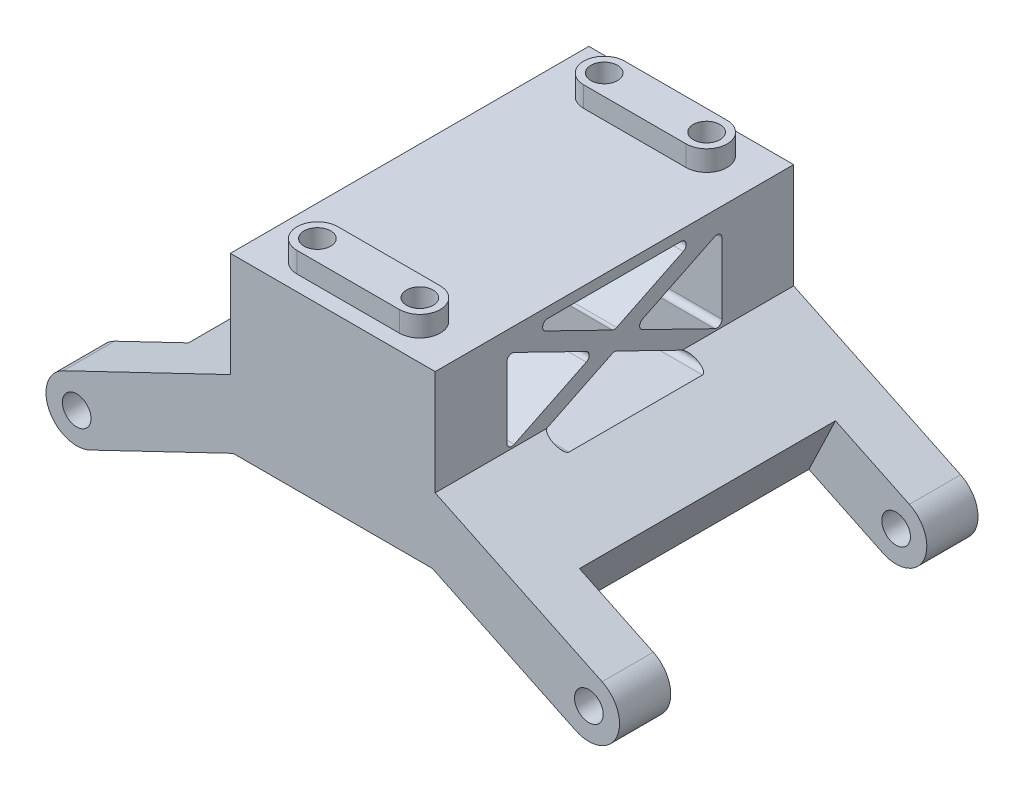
SolidWorks part; units mm, degrees
ref_plane "Front Plane" through (0, 0, 0) normal (0, 0, 1) x (1, 0, 0)
ref_plane "Top Plane" through (0, 0, 0) normal (0, 1, 0) x (1, 0, 0)
ref_plane "Right Plane" through (0, 0, 0) normal (1, 0, 0) x (0, 0, -1)
sketch "Sketch1" plane through (0, 0, 0) normal (0, 0, 1) x (1, 0, 0)
  line L0 (-31.75, -10.16) -> (31.75, -10.16) construction
  line L1 (-31.75, 15.24) -> (31.75, 15.24) construction
  line L2 (-31.75, 15.24) -> (-31.75, -15.24) construction
  line L3 (-31.75, -15.24) -> (31.75, -15.24) construction
  line L4 (31.75, 15.24) -> (31.75, -15.24) construction
  line L5 (-31.75, 15.24) -> (31.75, -15.24) construction
  line L6 (-31.75, -15.24) -> (31.75, 15.24) construction
  line L7 (-30.1013, -18.6748) -> (-12.3621, -10.16)
  line L8 (0, 15.24) -> (0, -15.24) construction
  line L9 (-30.1013, -18.6748) -> (-33.3987, -11.8052) construction
  line L10 (-33.3987, -11.8052) -> (-12.7, -1.8698)
  line L11 (12.3621, -10.16) -> (-12.3621, -10.16)
  line L12 (-12.7, 11.1536) -> (12.7, 11.1536)
  line L13 (-31.75, 11.1536) -> (0, 11.1536) construction
  line L14 (-12.7, -1.8698) -> (-12.7, 11.1536)
  line L15 (30.1013, -18.6748) -> (12.3621, -10.16)
  line L16 (33.3987, -11.8052) -> (12.7, -1.8698)
  line L17 (12.7, -1.8698) -> (12.7, 11.1536)
  arc A0 (-33.3987, -11.8052) -> (-30.1013, -18.6748) centre (-31.75, -15.24) ccw
  circle A3 centre (-31.75, 15.24) radius 4.0864 construction
  arc A4 (33.3987, -11.8052) -> (30.1013, -18.6748) centre (31.75, -15.24) cw
  point P0 (0, 0)
  point P9 (0, -10.16)
  dimension "D4" = 7.62
  dimension "D1" = 63.5
  dimension "D2" = 30.48
  dimension "D3" = 25.4
  dimension "D5" = 12.7
extrude "Boss-Extrude1" add sketch "Sketch1" along normal mid plane 44.45
sketch "Sketch3" plane through (-1.6487, 3.4348, 0) normal (-0.4327, 0.9015, 0) x (0.9015, 0.4327, 0)
  line L0 (-35.2182, -22.225) -> (-35.2182, 22.225) construction
  line L1 (-45.3782, 15.875) -> (-25.0582, 15.875)
  line L2 (-45.3782, 15.875) -> (-45.3782, -15.875)
  line L3 (-45.3782, -15.875) -> (-25.0582, -15.875)
  line L4 (-25.0582, 15.875) -> (-25.0582, -15.875)
  line L5 (-45.3782, 15.875) -> (-25.0582, -15.875) construction
  line L6 (-45.3782, -15.875) -> (-25.0582, 15.875) construction
  point P0 (-35.2182, 0)
  dimension "D1" = 10.16
  dimension "D2" = 31.75
extrude "Cut-Extrude1" cut sketch "Sketch3" against normal through all
mirror "Mirror1" about plane through (0, 0, 0) normal (1, 0, 0) of "Cut-Extrude1"
sketch "Sketch4" plane through (0, 11.1536, 0) normal (0, 1, 0) x (1, 0, 0)
  line L0 (0, 17.78) -> (0, -17.78) construction
  line L1 (-6.35, 17.78) -> (6.35, 17.78) construction
  line L2 (-6.35, 20.32) -> (6.35, 20.32)
  line L3 (-6.35, 15.24) -> (6.35, 15.24)
  line L4 (-6.35, -17.78) -> (6.35, -17.78) construction
  line L5 (-6.35, -15.24) -> (6.35, -15.24)
  line L6 (-6.35, -20.32) -> (6.35, -20.32)
  arc A0 (-6.35, 20.32) -> (-6.35, 15.24) centre (-6.35, 17.78) ccw
  arc A1 (6.35, 15.24) -> (6.35, 20.32) centre (6.35, 17.78) ccw
  arc A2 (-6.35, -15.24) -> (-6.35, -20.32) centre (-6.35, -17.78) ccw
  arc A3 (6.35, -20.32) -> (6.35, -15.24) centre (6.35, -17.78) ccw
  point P4 (0, 0)
  point P6 (0, 17.78)
  point P12 (0, -17.78)
  dimension "D4" = 2.54
  dimension "D5" = 2.54
  dimension "D1" = 35.56
  dimension "D2" = 12.7
  dimension "D3" = 12.7
extrude "Boss-Extrude2" add sketch "Sketch4" along normal blind 2.54
sketch "Sketch5" plane through (0, 13.6936, 0) normal (0, 1, 0) x (1, 0, 0)
  line L0 (-9.2893, 0) -> (9.2162, 0) construction
  circle A0 centre (-6.35, 17.78) radius 1.651
  circle A1 centre (6.35, 17.78) radius 1.651
  circle A2 centre (6.35, -17.78) radius 1.651
  circle A3 centre (-6.35, -17.78) radius 1.651
  dimension "D1" = 3.302
extrude "Cut-Extrude2" cut sketch "Sketch5" against normal through all
sketch "Sketch6" plane through (0, 0, 22.225) normal (0, 0, 1) x (1, 0, 0)
  circle A0 centre (-31.75, -15.24) radius 1.778
  circle A1 centre (31.75, -15.24) radius 1.778
  dimension "D1" = 3.556
extrude "Cut-Extrude3" cut sketch "Sketch6" against normal through all
sketch "Sketch8" plane through (0, 0, 0) normal (1, 0, 0) x (0, 0, -1)
  line L0 (-22.225, 11.1536) -> (22.225, 11.1536) construction
  line L1 (-13.335, 9.8836) -> (13.335, 9.8836) construction
  line L2 (-13.335, 9.8836) -> (-13.335, -3.1398) construction
  line L3 (-13.335, -3.1398) -> (13.335, -3.1398) construction
  line L4 (13.335, 9.8836) -> (13.335, -3.1398) construction
  line L5 (-22.225, -1.8698) -> (22.225, -1.8698) construction
  line L6 (-15.24, 13.6936) -> (-15.24, 11.1536) construction
  line L7 (15.24, 13.6936) -> (15.24, 11.1536) construction
  line L8 (-13.335, -3.1398) -> (13.335, 9.8836) construction
  line L9 (-13.335, 9.8836) -> (13.335, -3.1398) construction
  line L11 (-8.5507, -1.9342) -> (-0.2786, 2.1052)
  line L12 (-12.4214, -1.563) -> (-3.4839, 2.8013)
  line L14 (-8.5507, 8.678) -> (-0.2786, 4.6386)
  line L15 (-12.4214, 8.3068) -> (-3.4839, 3.9425)
  line L16 (0, 9.8836) -> (0, -3.1398) construction
  line L17 (-13.335, 7.7362) -> (-13.335, -0.9924)
  line L18 (-8.272, -3.1398) -> (8.272, -3.1398)
  line L19 (-8.272, 9.8836) -> (8.272, 9.8836)
  line L20 (13.335, 7.7362) -> (13.335, -0.9924)
  line L21 (12.4214, 8.3068) -> (3.4839, 3.9425)
  line L22 (12.4214, -1.563) -> (3.4839, 2.8013)
  line L23 (8.5507, -1.9342) -> (0.2786, 2.1052)
  line L24 (8.5507, 8.678) -> (0.2786, 4.6386)
  arc A0 (-3.4839, 3.9425) -> (-3.4839, 2.8013) centre (-3.7626, 3.3719) cw
  arc A1 (-12.4214, -1.563) -> (-13.335, -0.9924) centre (-12.7, -0.9924) cw
  arc A2 (-12.4214, 8.3068) -> (-13.335, 7.7362) centre (-12.7, 7.7362) ccw
  arc A3 (-8.5507, -1.9342) -> (-8.272, -3.1398) centre (-8.272, -2.5048) ccw
  arc A4 (-8.5507, 8.678) -> (-8.272, 9.8836) centre (-8.272, 9.2486) cw
  arc A5 (12.4214, 8.3068) -> (13.335, 7.7362) centre (12.7, 7.7362) cw
  arc A6 (3.4839, 3.9425) -> (3.4839, 2.8013) centre (3.7626, 3.3719) ccw
  arc A7 (12.4214, -1.563) -> (13.335, -0.9924) centre (12.7, -0.9924) ccw
  arc A8 (8.5507, -1.9342) -> (8.272, -3.1398) centre (8.272, -2.5048) cw
  arc A9 (8.5507, 8.678) -> (8.272, 9.8836) centre (8.272, 9.2486) ccw
  arc A10 (-0.2786, 4.6386) -> (0.2786, 4.6386) centre (0, 5.2092) ccw
  arc A11 (-0.2786, 2.1052) -> (0.2786, 2.1052) centre (0, 1.5346) cw
  point P25 (-13.335, -2.0092)
  point P28 (-13.335, 8.753)
  point P31 (-11.0196, -3.1398)
  point P34 (-11.0196, 9.8836)
  point P52 (0, 4.5026)
  point P55 (0, 2.2412)
  dimension "D9" = 0.635
  dimension "D10" = 0.635
  dimension "D11" = 0.635
  dimension "D1" = 1.27
  dimension "D2" = 1.27
  dimension "D3" = 1.905
  dimension "D4" = 1.905
  dimension "D5" = 2.032
  dimension "D6" = 1.016
  dimension "D7" = 1.016
  dimension "D8" = 1.016
extrude "Cut-Extrude4" cut sketch "Sketch8" against normal through all both and the other way through all
